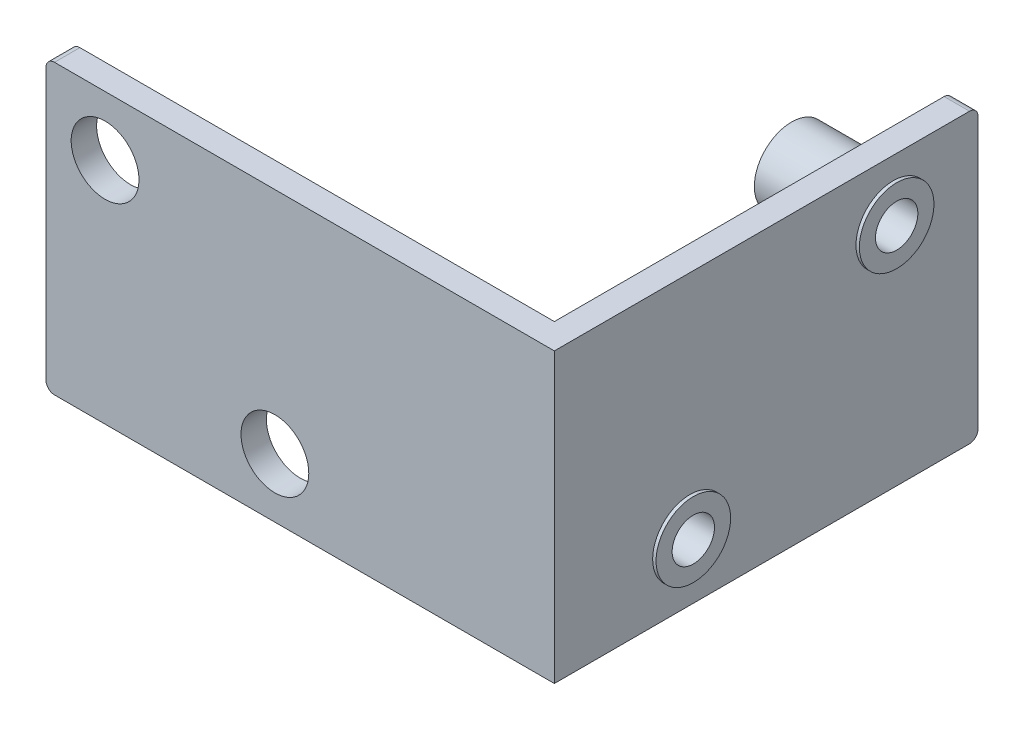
SolidWorks part; units mm, degrees
ref_plane "Plan de face" through (0, 0, 0) normal (0, 0, 1) x (1, 0, 0)
ref_plane "Plan de dessus" through (0, 0, 0) normal (0, 1, 0) x (1, 0, 0)
ref_plane "Plan de droite" through (0, 0, 0) normal (1, 0, 0) x (0, 0, -1)
sketch "Esquisse1" plane through (0, 0, 0) normal (0, 0, 1) x (1, 0, 0)
  line L1 (-8.9489, -18.5667) -> (21.0511, -18.5667)
  line L2 (-8.9489, -18.5667) -> (-8.9489, -1.5667)
  line L3 (-8.9489, -1.5667) -> (21.0511, -1.5667)
  line L4 (21.0511, -18.5667) -> (21.0511, -1.5667)
  dimension "D1" = 30
extrude "Extrusion1" add sketch "Esquisse1" along normal blind 1.5
sketch "Esquisse2" plane through (0, 0, 1.5) normal (0, 0, 1) x (1, 0, 0)
  circle A0 centre (-5.4631, -5.0762) radius 2
  circle A1 centre (4.5584, -15.0701) radius 2
extrude "Enlèv. mat.-Extru.1" cut sketch "Esquisse2" against normal blind 2
sketch "Esquisse3" plane through (0, 0, 0) normal (0, 0, -1) x (-1, 0, 0)
  line L0 (8.9489, -18.5667) -> (-21.0511, -18.5667) construction
  line L1 (-21.0511, -1.5667) -> (-19.5511, -1.5667)
  line L2 (-21.0511, -1.5667) -> (-21.0511, -18.5667)
  line L3 (-21.0511, -18.5667) -> (-19.5511, -18.5667)
  line L4 (-19.5511, -1.5667) -> (-19.5511, -18.5667)
  dimension "D1" = 1.5
extrude "Extrusion2" add sketch "Esquisse3" along normal blind 23.5
sketch "Esquisse4" plane through (21.0511, 0, 0) normal (1, 0, 0) x (0, 0, -1)
  line L0 (-1.5, -10.0667) -> (22.2784, -10.0667) construction
  line L1 (-1.5, -18.5667) -> (-1.5, -1.5667) construction
  line L2 (11, -1.5667) -> (11, -17.0068) construction
  line L3 (-1.5, -1.5667) -> (23.5, -1.5667) construction
  line L4 (-3, -15.0667) -> (15.7036, -15.0667) construction
  line L6 (-3, -5.0667) -> (20.9635, -5.0667) construction
  circle A0 centre (6.5, -15.1074) radius 1.25
  circle A1 centre (18.5, -5.0667) radius 1.25
  dimension "D1" = 7.5
  dimension "D2" = 4.5
extrude "Enlèv. mat.-Extru.2" cut sketch "Esquisse4" against normal blind 2
sketch "Esquisse5" plane through (21.0511, 0, 0) normal (1, 0, 0) x (0, 0, -1)
  circle A0 centre (6.5, -15.1074) radius 1.25
  circle A1 centre (6.5, -15.1074) radius 2.2
  circle A2 centre (18.5, -5.0667) radius 1.25
  circle A3 centre (18.5, -5.0667) radius 2.2
extrude "Extrusion3" add sketch "Esquisse5" along normal blind 0.2 and the other way blind 6
fillet "Congé1" radius 0.5 4 edges at (20.3011, -18.5667, -23.5) (20.3011, -1.5667, -23.5) (-8.9489, -18.5667, 0.75) (-8.9489, -1.5667, 0.75)
